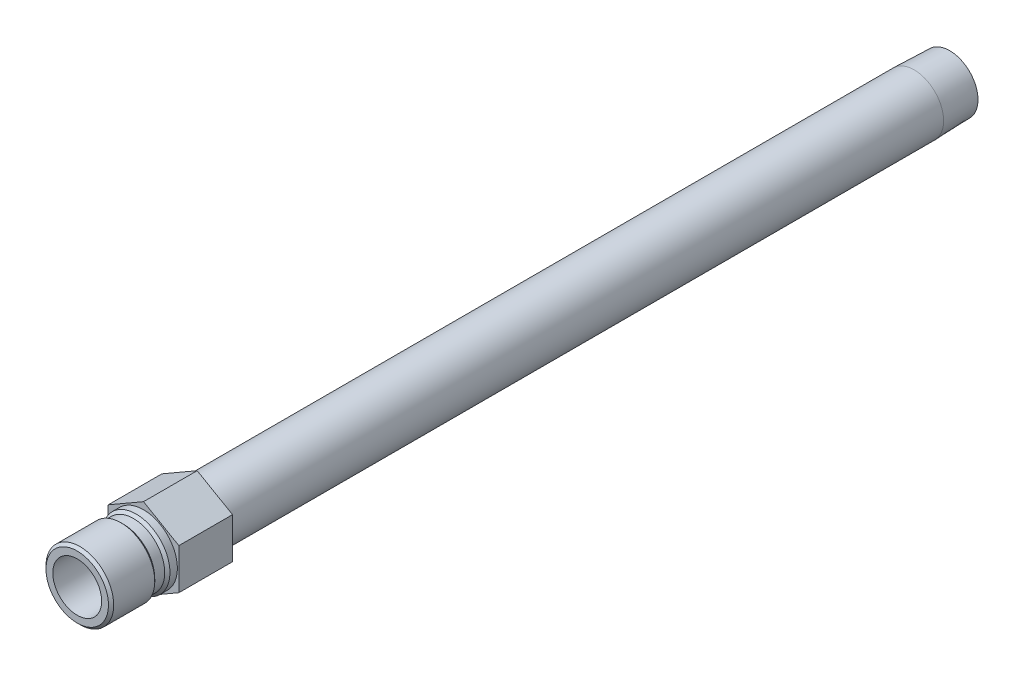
SolidWorks part; units mm, degrees
ref_plane "Front Plane" through (0, 0, 0) normal (0, 0, 1) x (1, 0, 0)
ref_plane "Top Plane" through (0, 0, 0) normal (0, 1, 0) x (1, 0, 0)
ref_plane "Right Plane" through (0, 0, 0) normal (1, 0, 0) x (0, 0, -1)
sketch "Sketch1" plane through (0, 0, 0) normal (1, 0, 0) x (0, 0, -1)
  line L0 (0, 0) -> (-22.479, 0) construction
  line L1 (-19.304, 7.112) -> (-19.304, 9.0932)
  line L2 (-5.8166, 9.0932) -> (-5.8166, 0) construction
  line L3 (-18.542, 9.8552) -> (-6.5786, 9.8552)
  line L4 (0, 8.5725) -> (0, 0) construction
  line L5 (-5.8166, 9.0932) -> (-2.921, 9.0932)
  line L6 (-2.159, 9.8552) -> (0, 9.8552)
  line L7 (0, 9.8552) -> (0, 8.5725)
  line L8 (-5.8166, 9.0932) -> (-6.5786, 9.8552)
  line L9 (-2.921, 9.0932) -> (-2.159, 9.8552)
  line L10 (-19.304, 9.0932) -> (-18.542, 9.8552)
  line L11 (-19.304, 7.112) -> (-1.524, 7.112)
  line L12 (0, 8.5725) -> (224.3582, 8.5725)
  line L13 (224.3582, 8.5725) -> (234.696, 8.2494)
  line L14 (234.696, 8.2494) -> (234.696, 6.2611)
  line L15 (0, 9.8552) -> (15.621, 9.8552) construction
  line L16 (15.621, 9.8552) -> (15.621, 0) construction
  line L17 (15.621, 0) -> (0, 0) construction
  line L18 (-1.0716, 6.2611) -> (-1.524, 7.112)
  line L19 (-1.0716, 6.2611) -> (234.696, 6.2611)
  dimension "D1" = 19.304
  dimension "D2" = 2.8956
  dimension "D3" = 0.762
  dimension "D4" = 45
  dimension "D5" = 13.4874
  dimension "D6" = 45
  dimension "D7" = 1.79
  dimension "D8" = 10.3378
  dimension "D9" = 254
  dimension "D10" = 3.175
  dimension "D11" = 34.925
  dimension "D12" = 14.224
  dimension "D13" = 17.145
  dimension "D14" = 19.7104
  dimension "D15" = 12.5222
  dimension "D16" = 118
  dimension "D17" = 17.78
revolve "Revolve1" add sketch "Sketch1" angle 360 about L0
sketch "Sketch2" plane through (0, 0, 0) normal (0, 0, 1) x (1, 0, 0)
  line L1 (-10.287, 5.9392) -> (-10.287, -5.9392)
  line L2 (-10.287, -5.9392) -> (0, -11.8784)
  line L3 (0, -11.8784) -> (10.287, -5.9392)
  line L4 (10.287, -5.9392) -> (10.287, 5.9392)
  line L5 (10.287, 5.9392) -> (0, 11.8784)
  line L6 (0, 11.8784) -> (-10.287, 5.9392)
  circle A0 centre (0, 0) radius 10.287 construction
  circle A1 centre (0, 0) radius 7.112 construction
  circle A2 centre (0, 0) radius 7.112
  dimension "D1" = 20.574
extrude "Boss-Extrude1" add sketch "Sketch2" against normal up to vertex (15.621 mm away) from vertex at 0
